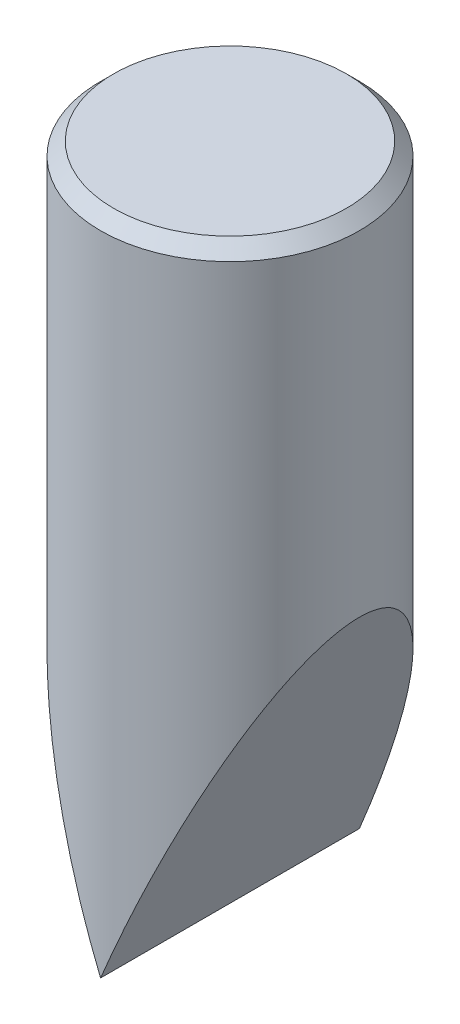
SolidWorks part; units mm, degrees
ref_plane "Спереди" through (0, 0, 0) normal (0, 0, 1) x (1, 0, 0)
ref_plane "Сверху" through (0, 0, 0) normal (0, 1, 0) x (1, 0, 0)
ref_plane "Справа" through (0, 0, 0) normal (1, 0, 0) x (0, 0, -1)
sketch "Эскиз1" plane through (0, 0, 0) normal (0, 1, 0) x (1, 0, 0)
  circle A0 centre (0, 0) radius 5
  dimension "D1" = 10
extrude "Бобышка-Вытянуть1" add sketch "Эскиз1" along normal blind 25.5
sketch "Эскиз2" plane through (0, 0, 0) normal (0, 0, 1) x (1, 0, 0)
  line L0 (0, 0) -> (5, 12.0711)
  line L1 (5, 12.0711) -> (5, -4.4313)
  line L2 (5, -4.4313) -> (-5, -4.4313)
  line L3 (-5, -4.4313) -> (-5, 12.0711)
  line L4 (-5, 25.5) -> (-5, 0) construction
  line L5 (-5, 12.0711) -> (0, 0)
  line L6 (5, 0) -> (5, 25.5) construction
  dimension "D1" = 45
extrude "Вырез-Вытянуть1" cut sketch "Эскиз2" against normal mid plane 25.5
chamfer "Фаска1" distance 0.5 angle 45 1 edges at (0, 25.5, 5)
